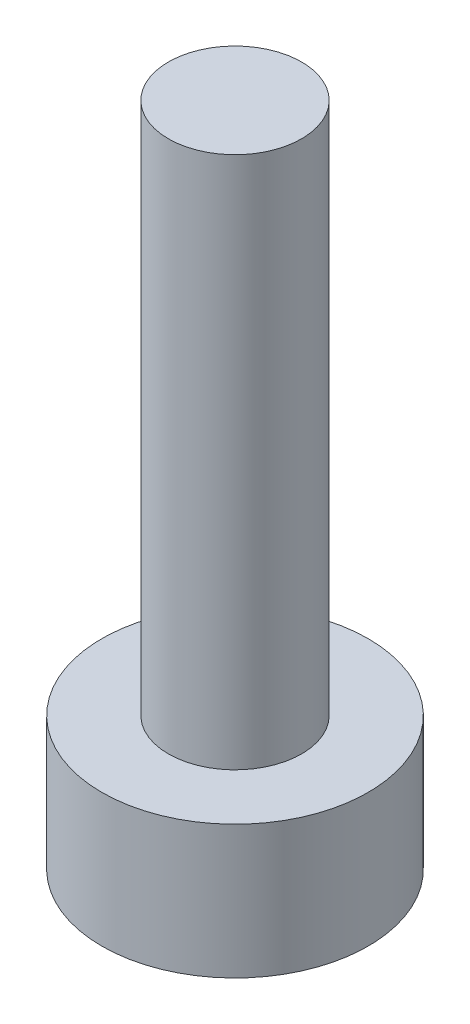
SolidWorks part; units mm, degrees
ref_plane "Face" through (0, 0, 0) normal (0, 0, 1) x (1, 0, 0)
ref_plane "Dessus" through (0, 0, 0) normal (0, 1, 0) x (1, 0, 0)
ref_plane "Droite" through (0, 0, 0) normal (1, 0, 0) x (0, 0, -1)
sketch "Esquisse1" plane through (0, 0, 0) normal (0, 0, 1) x (1, 0, 0)
  line L0 (0, 49.4323) -> (0, -48.5112) construction
  line L1 (0, 0) -> (-4, 0)
  line L2 (-4, 0) -> (-4, 4)
  line L3 (-4, 4) -> (-2, 4)
  line L4 (-2, 4) -> (-2, 20)
  line L5 (-2, 20) -> (0, 20)
  line L6 (0, 20) -> (0, 0)
  dimension "D1" = 20
  dimension "D2" = 4
  dimension "D3" = 8
  dimension "D4" = 2
revolve "Base-Révolution" add sketch "Esquisse1" angle 360 about L0
